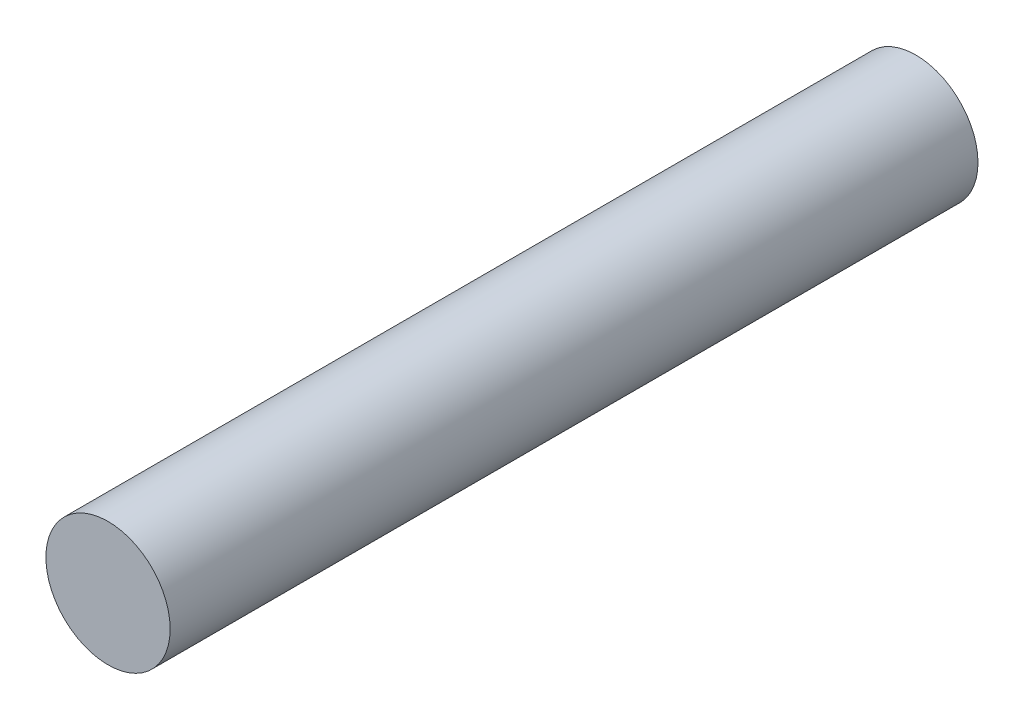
SolidWorks part; units mm, degrees
ref_plane "Front" through (0, 0, 0) normal (0, 0, 1) x (1, 0, 0)
ref_plane "Top" through (0, 0, 0) normal (0, 1, 0) x (1, 0, 0)
ref_plane "Right" through (0, 0, 0) normal (1, 0, 0) x (0, 0, -1)
sketch "Sketch1" plane through (0, 0, 0) normal (0, 0, 1) x (1, 0, 0)
  circle A0 centre (0, 0) radius 12.7 construction
  circle A1 centre (0, 0) radius 12.7
extrude "Extrude1" add sketch "Sketch1" against normal blind 152.4 and the other way blind 12.7
